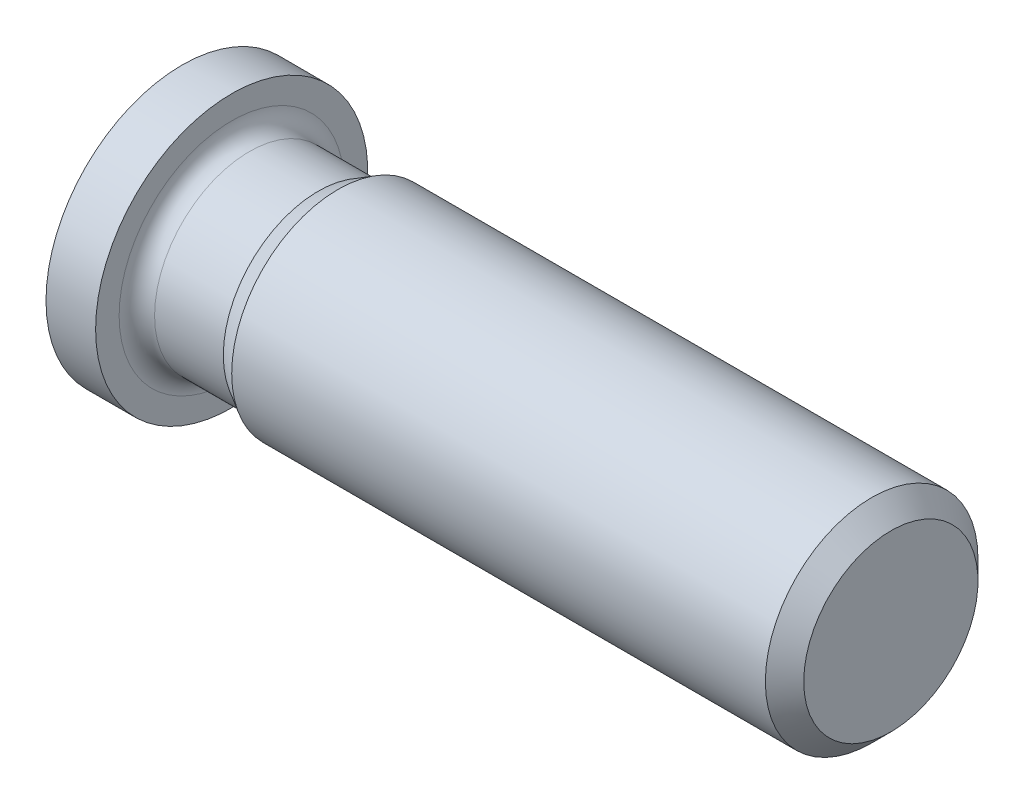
SolidWorks part; units mm, degrees
ref_plane "Front" through (0, 0, 0) normal (0, 0, 1) x (1, 0, 0)
ref_plane "Top" through (0, 0, 0) normal (0, 1, 0) x (1, 0, 0)
ref_plane "Right" through (0, 0, 0) normal (1, 0, 0) x (0, 0, -1)
other "Configuration Table"
sketch "Sketch1" plane through (0, 0, 0) normal (0, 0, 1) x (1, 0, 0)
  line L0 (0, 0) -> (22.7419, 0) construction
  line L1 (0, 0) -> (0, 0.44)
  line L2 (0, 0.44) -> (0.83, 0.9192)
  line L3 (0.83, 0.9192) -> (1.137, 3.84)
  line L4 (1.137, 3.84) -> (2.537, 3.84)
  line L5 (3.037, 3) -> (5.537, 3) construction
  line L6 (21.137, 3) -> (21.137, 0)
  line L7 (21.137, 0) -> (0, 0)
  line L8 (1.137, 3.84) -> (1.137, -8.0526) construction
  line L9 (2.537, 3.84) -> (2.537, 3.1765)
  line L10 (5.537, 3) -> (21.137, 3)
  line L11 (5.537, 3) -> (4.9767, 2.6765)
  line L12 (4.9767, 2.6765) -> (3.037, 2.6765)
  arc A0 (3.037, 2.6765) -> (2.537, 3.1765) centre (3.037, 3.1765) cw
revolve "Base" add sketch "Sketch1" angle 360 about L0
chamfer "EndChamfer" distance 0.5415 angle 45 1 edges at (21.137, 0, 3)
ref_plane "Plane1" through (4.037, 0, 0) normal (1, 0, 0) x (0, 0, -1)
sketch "Sketch2" plane through (0, 0, 0) normal (0, 0, 1) x (1, 0, 0)
  line L0 (20.5955, 2.531) -> (20.8662, 3)
  line L1 (20.8662, 3) -> (20.8662, 3.5)
  line L2 (20.8662, 3.5) -> (20.3247, 3.5)
  line L3 (20.3247, 3.5) -> (20.3247, 3)
  line L4 (20.3247, 3) -> (20.5955, 2.531)
  line L5 (0, 0) -> (22.4926, 0) construction
  line L7 (20.5955, 3) -> (20.5955, -3) construction
revolve "Cut-Revolve10" [suppressed] cut sketch "Sketch2" angle 360 about L5
pattern_linear "LPattern10" [suppressed] count 24 spacing 0.6498 along (1, 0, 0)
equation "\"D1@ThreadCosmetic1\" = \"l@Sketch1\" - \"h@Sketch1\" -\"a@Sketch1\""
equation "\"D1@EndChamfer\" =  ( \"d@Sketch1\" - \"D2@ThreadCosmetic1\" )  / 2"
equation "\"D5@Sketch2\" = \"d@Sketch1\""
equation "\"D4@Sketch2\" = (  \"d@Sketch1\" - \"D2@ThreadCosmetic1\" )  / 2"
equation "\"D3@LPattern10\" = \"D4@Sketch2\" * 1.2"
equation "\"D1@LPattern10\" = \"D1@ThreadCosmetic1\" / \"D3@LPattern10\""
